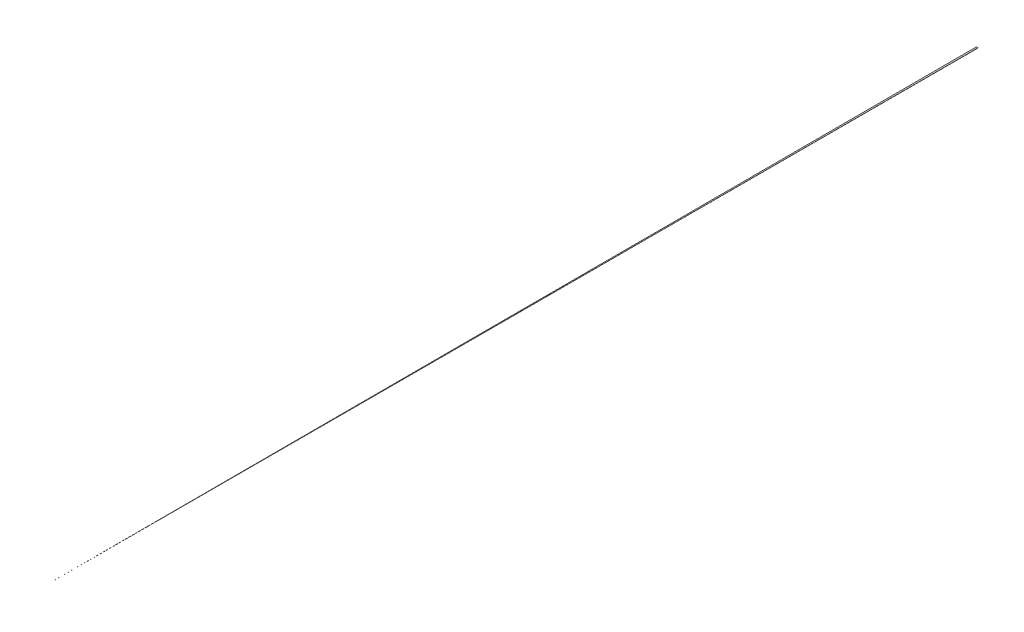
SolidWorks part; units mm, degrees
ref_plane "Plan de face" through (0, 0, 0) normal (0, 0, 1) x (1, 0, 0)
ref_plane "Plan de dessus" through (0, 0, 0) normal (0, 1, 0) x (1, 0, 0)
ref_plane "Plan de droite" through (0, 0, 0) normal (1, 0, 0) x (0, 0, -1)
sketch "Esquisse1" plane through (0, 0, 0) normal (0, 0, 1) x (1, 0, 0)
  line L4 (28.7, -16.75) -> (-28.7, -16.75)
  line L5 (28.7, -23.25) -> (28.7, -16.75)
  line L6 (-28.7, -23.25) -> (28.7, -23.25)
  line L7 (-28.7, -16.75) -> (-28.7, -23.25)
  line L8 (28.7, -16.75) -> (-28.7, -16.75)
  line L9 (28.7, -23.25) -> (28.7, -16.75)
  line L10 (-28.7, -23.25) -> (28.7, -23.25)
  line L11 (-28.7, -16.75) -> (-28.7, -23.25)
  dimension "D1" = 0
sketch "Esquisse2" plane through (-0.028, -20, 31878.1844) normal (0, 0, 1) x (1, 0, 0)
  line L1 (-0.05, -0.05) -> (0.05, -0.05)
  line L2 (-0.05, -0.05) -> (-0.05, 0.05)
  line L3 (-0.05, 0.05) -> (0.05, 0.05)
  line L4 (0.05, -0.05) -> (0.05, 0.05)
  line L5 (-0.05, -0.05) -> (0.05, 0.05) construction
  line L6 (-0.05, 0.05) -> (0.05, -0.05) construction
  point P0 (0, 0)
  dimension "D1" = 0.1
loft "Lissage1" add profiles "Esquisse1", "Esquisse2"
ref_plane "Plan1" through (0, 0, -200) normal (0, 0, -1) x (-1, 0, 0)
sketch3d "Esquisse3D1"
  line L0 (-28.7, -23.25, 0) -> (-0.078, -20.05, 31878.1844) construction
  line L1 (-28.7, -16.75, 0) -> (-0.078, -19.95, 31878.1844) construction
  line L2 (-28.8796, -23.2701, -200) -> (-0.078, -20.05, 31878.1844)
  line L3 (-28.8796, -16.7299, -200) -> (-0.078, -19.95, 31878.1844)
  line L4 (28.7, -16.75, 0) -> (0.022, -19.95, 31878.1844) construction
  line L5 (28.8799, -16.7299, -200) -> (0.022, -19.95, 31878.1844)
  line L6 (28.7, -23.25, 0) -> (0.022, -20.05, 31878.1844) construction
  line L7 (28.8799, -23.2701, -200) -> (0.022, -20.05, 31878.1844)
sketch "Esquisse3" plane through (0, 0, 0) normal (0, 0, -1) x (-1, 0, 0)
  line L4 (28.7, -23.25) -> (28.7, -16.75)
  line L5 (28.7, -16.75) -> (-28.7, -16.75)
  line L6 (-28.7, -16.75) -> (-28.7, -23.25)
  line L7 (-28.7, -23.25) -> (28.7, -23.25)
  line L8 (28.7, -23.25) -> (28.7, -16.75)
  line L9 (28.7, -16.75) -> (-28.7, -16.75)
  line L10 (-28.7, -16.75) -> (-28.7, -23.25)
  line L11 (-28.7, -23.25) -> (28.7, -23.25)
  dimension "D1" = 0
sketch "Esquisse4" plane through (0, 0, -200) normal (0, 0, -1) x (-1, 0, 0)
  line L1 (28.8796, -16.7299) -> (-28.8799, -16.7299)
  line L2 (28.8796, -16.7299) -> (28.8796, -23.2701)
  line L3 (28.8796, -23.2701) -> (-28.8799, -23.2701)
  line L4 (-28.8799, -16.7299) -> (-28.8799, -23.2701)
loft "Lissage2" add profiles "Esquisse4", "Esquisse3"
